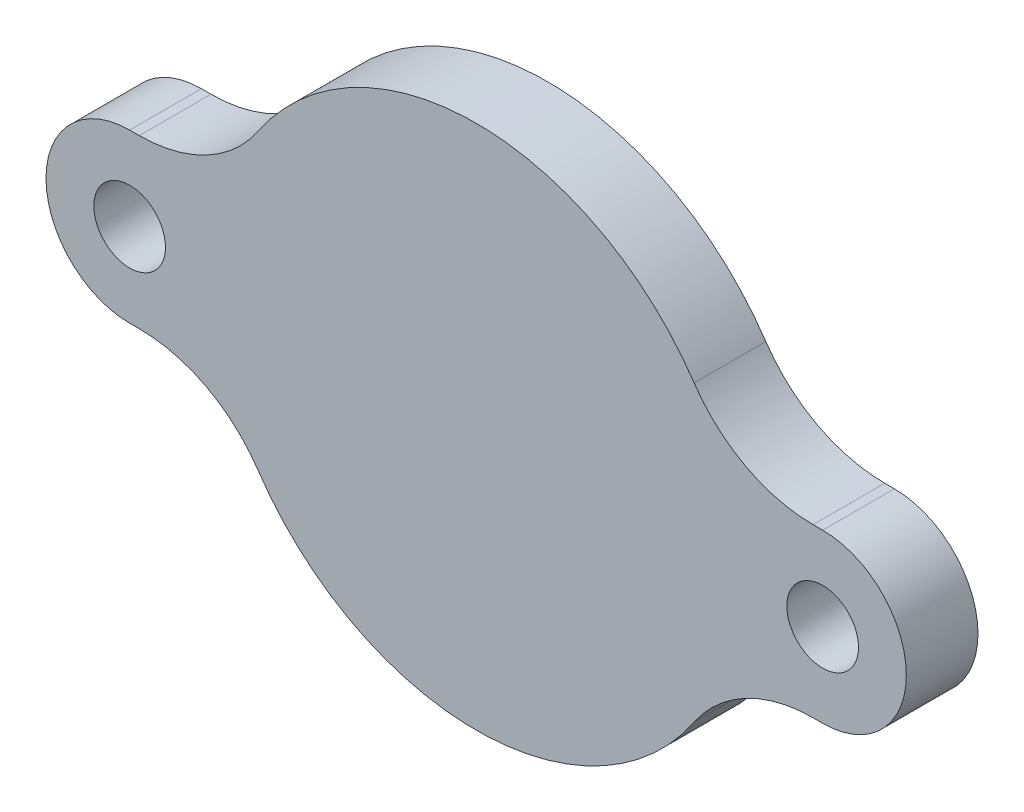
SolidWorks part; units mm, degrees
ref_plane "Front Plane" through (0, 0, 0) normal (0, 0, 1) x (1, 0, 0)
ref_plane "Top Plane" through (0, 0, 0) normal (0, 1, 0) x (1, 0, 0)
ref_plane "Right Plane" through (0, 0, 0) normal (1, 0, 0) x (0, 0, -1)
sketch "Sketch1" plane through (0, 0, 0) normal (0, 0, 1) x (1, 0, 0)
  line L8 (14.5, 3.5) -> (14.0979, 3.5)
  line L9 (-14.0979, 3.5) -> (-14.5, 3.5)
  line L10 (-14.5, -3.5) -> (-14.0979, -3.5)
  line L11 (14.0979, -3.5) -> (14.5, -3.5)
  circle A2 centre (14.5, 0) radius 1.5
  circle A3 centre (-14.5, 0) radius 1.5
  arc A16 (9.1222, 6.1471) -> (14.0979, 3.5) centre (14.0979, 9.5) ccw
  arc A17 (9.1222, 6.1471) -> (-9.1222, 6.1471) centre (0, 0) ccw
  arc A18 (-14.0979, 3.5) -> (-9.1222, 6.1471) centre (-14.0979, 9.5) ccw
  arc A19 (-14.5, 3.5) -> (-14.5, -3.5) centre (-14.5, 0) ccw
  arc A20 (-9.1222, -6.1471) -> (-14.0979, -3.5) centre (-14.0979, -9.5) ccw
  arc A21 (-9.1222, -6.1471) -> (9.1222, -6.1471) centre (0, 0) ccw
  arc A22 (14.0979, -3.5) -> (9.1222, -6.1471) centre (14.0979, -9.5) ccw
  arc A23 (14.5, -3.5) -> (14.5, 3.5) centre (14.5, 0) ccw
extrude "Boss-Extrude1" add sketch "Sketch1" along normal blind 3
